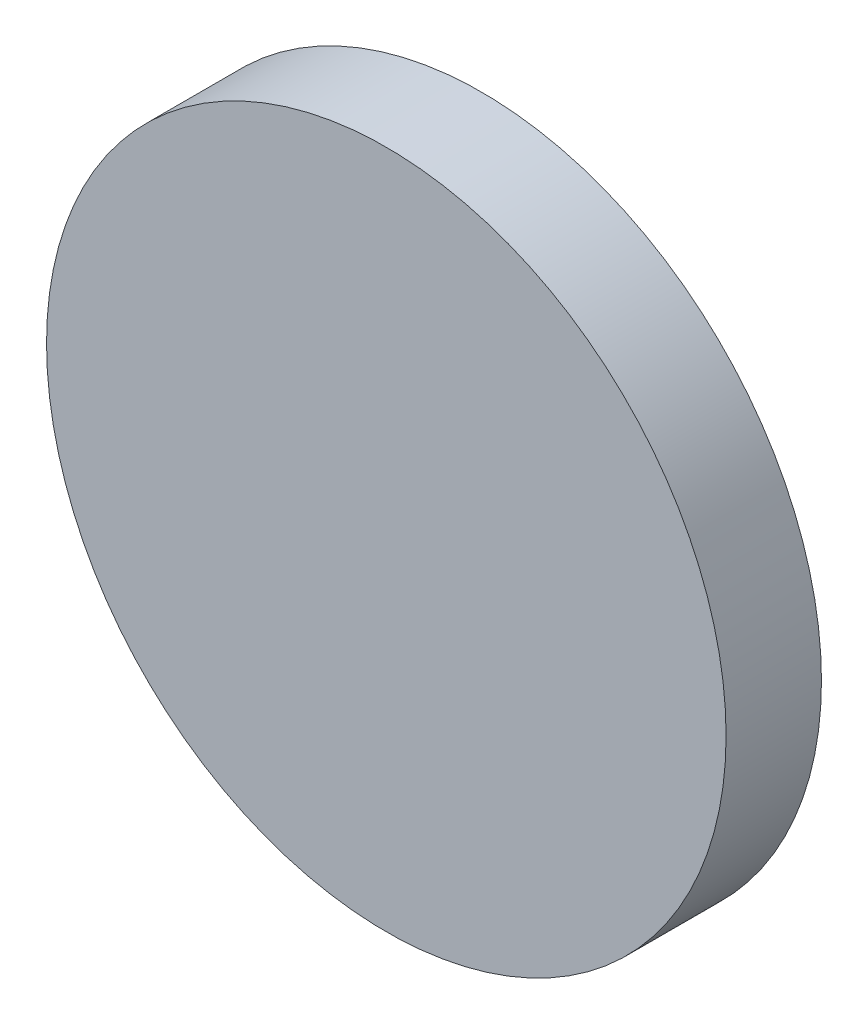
SolidWorks part; units mm, degrees
ref_plane "front" through (0, 0, 0) normal (0, 0, 1) x (1, 0, 0)
ref_plane "top" through (0, 0, 0) normal (0, 1, 0) x (1, 0, 0)
ref_plane "side" through (0, 0, 0) normal (1, 0, 0) x (0, 0, -1)
sketch "Sketch1" plane through (0, 0, 0) normal (0, 0, 1) x (1, 0, 0)
  circle A0 centre (0, 0) radius 6.5151
  dimension "D1" = 13.0302
extrude "Boss-Extrude1" add sketch "Sketch1" along normal blind 1.8288
